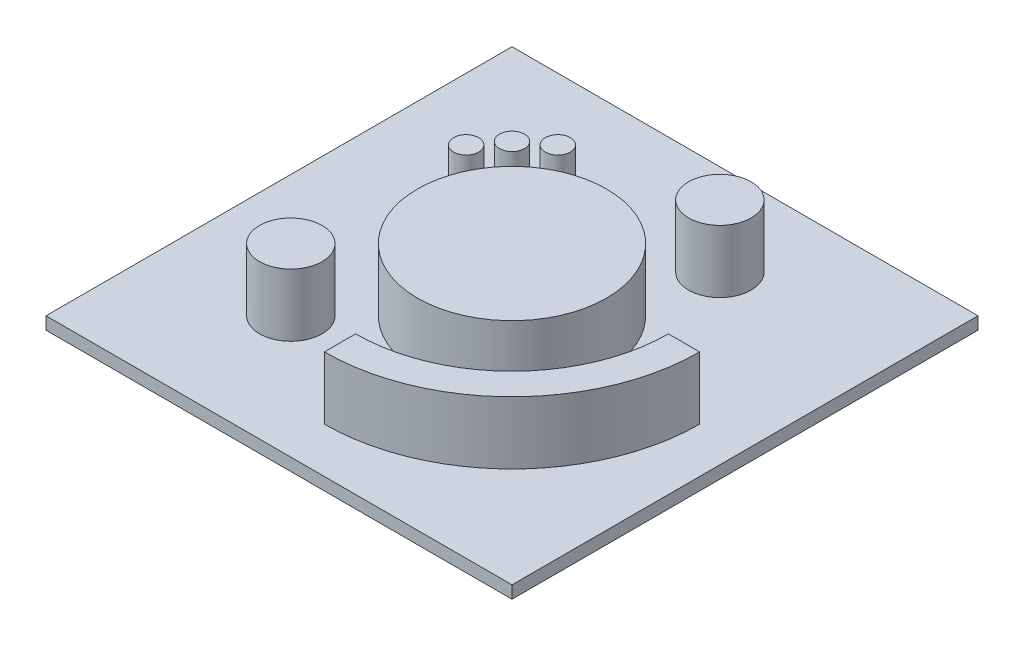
SolidWorks part; units mm, degrees
ref_plane "Front Plane" through (0, 0, 0) normal (0, 0, 1) x (1, 0, 0)
ref_plane "Top Plane" through (0, 0, 0) normal (0, 1, 0) x (1, 0, 0)
ref_plane "Right Plane" through (0, 0, 0) normal (1, 0, 0) x (0, 0, -1)
sketch "Sketch1" plane through (0, 0, 0) normal (0, 1, 0) x (1, 0, 0)
  line L0 (-47.2963, 47.2963) -> (47.2963, -47.2963) construction
  line L1 (-47.2963, -47.2963) -> (47.2963, -47.2963)
  line L2 (-47.2963, -47.2963) -> (-47.2963, 47.2963)
  line L3 (-47.2963, 47.2963) -> (47.2963, 47.2963)
  line L4 (47.2963, -47.2963) -> (47.2963, 47.2963)
extrude "Extrude1" add sketch "Sketch1" along normal blind 2.54
sketch "Sketch2" plane through (0, 2.54, 0) normal (0, 1, 0) x (-1, 0, 0)
  line L1 (0, 31.75) -> (0, 38.1)
  line L2 (0, 0) -> (12.7, -21.997) construction
  line L3 (0, 0) -> (17.9605, -17.9605) construction
  line L4 (0, 0) -> (21.997, -12.7) construction
  line L5 (0, 0) -> (42.7666, 0) construction
  line L6 (0, 0) -> (-13.4181, -28.7753) construction
  line L7 (0, 0) -> (22.4506, 22.4506) construction
  line L8 (-31.75, 0) -> (-38.1, 0)
  circle A0 centre (0, 0) radius 19.185
  circle A1 centre (0, 0) radius 31.75 construction
  circle A2 centre (12.7, -21.997) radius 2.54
  circle A3 centre (17.9605, -17.9605) radius 2.54
  circle A4 centre (21.997, -12.7) radius 2.54
  circle A5 centre (0, 0) radius 25.4 construction
  circle A6 centre (-13.4181, -28.7753) radius 6.35
  circle A7 centre (22.4506, 22.4506) radius 6.35
  arc A8 (-31.75, 0) -> (0, 31.75) centre (0, 0) cw
  arc A9 (0, 38.1) -> (-38.1, 0) centre (0, 0) ccw
  dimension "D4" = 65
  dimension "D5" = 63.5
  dimension "D6" = 50.8
  dimension "D7" = 5.08
  dimension "D9" = 38.1
  dimension "D1" = 30
  dimension "D2" = 15
  dimension "D3" = 15
  dimension "D8" = 45
extrude "Extrude2" add sketch "Sketch2" along normal blind 12.7
